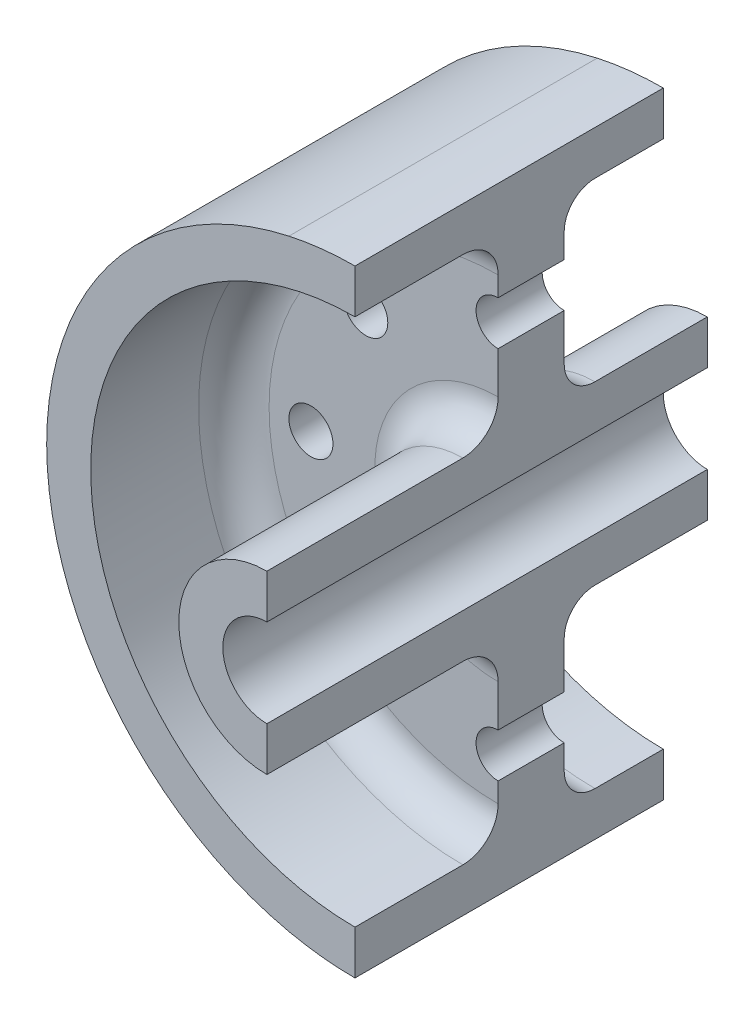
SolidWorks part; units mm, degrees
ref_plane "Front Plane" through (0, 0, 0) normal (0, 0, 1) x (1, 0, 0)
ref_plane "Top Plane" through (0, 0, 0) normal (0, 1, 0) x (1, 0, 0)
ref_plane "Right Plane" through (0, 0, 0) normal (1, 0, 0) x (0, 0, -1)
sketch "Sketch1" plane through (0, 0, 0) normal (1, 0, 0) x (0, 0, -1)
  line L0 (0, 0) -> (254, 0) construction
  line L1 (0, 25.4) -> (254, 25.4)
  line L2 (254, 25.4) -> (254, 50.8)
  line L3 (254, 50.8) -> (171.45, 50.8)
  line L4 (0, 50.8) -> (0, 25.4)
  line L5 (133.35, 50.8) -> (133.35, 152.4)
  line L6 (133.35, 152.4) -> (50.8, 152.4)
  line L7 (50.8, 152.4) -> (50.8, 177.8)
  line L8 (50.8, 177.8) -> (228.6, 177.8)
  line L9 (228.6, 177.8) -> (228.6, 152.4)
  line L10 (228.6, 152.4) -> (171.45, 152.4)
  line L11 (171.45, 152.4) -> (171.45, 50.8)
  line L12 (133.35, 50.8) -> (0, 50.8)
  dimension "D1" = 254
  dimension "D2" = 25.4
  dimension "D3" = 50.8
  dimension "D4" = 152.4
  dimension "D5" = 177.8
  dimension "D6" = 50.8
  dimension "D7" = 133.35
  dimension "D8" = 171.45
  dimension "D9" = 228.6
revolve "Revolve1" add sketch "Sketch1" angle 360 about L0
sketch "Sketch2" plane through (0, 0, 0) normal (0, 0, 1) x (1, 0, 0)
  circle A0 centre (0, 107.95) radius 12.7
  dimension "D1" = 25.4
  dimension "D2" = 107.95
extrude "Extrude1" cut sketch "Sketch2" against normal through all
pattern_circular "CirPattern1" count 8 over 360 about axis through (0, 0, 0) along (0, 0, 1) of "Extrude1"
fillet "Fillet1" radius 20.32 1 edges at (152.4, 0, -133.35)
fillet "Fillet4" radius 20.32 1 edges at (50.8, 0, -133.35)
fillet "Fillet2" radius 17.78 1 edges at (152.4, 0, -171.45)
fillet "Fillet3" radius 17.78 1 edges at (50.8, 0, -171.45)
sketch "Sketch7" plane through (0, 0, 0) normal (0, 1, 0) x (1, 0, 0)
  line L0 (-38.1, 268.1025) -> (-38.1, -3.5575)
  point P2 (0, 0)
  dimension "D1" = 38.1
sketch "Sketch8" plane through (0, 0, 0) normal (0, 1, 0) x (1, 0, 0)
  line L0 (38.1, 261.0725) -> (38.1, 0)
  dimension "D1" = 38.1
sketch "Sketch6" plane through (0, 0, 0) normal (0, 0, 1) x (1, 0, 0)
  line L1 (0, -194.9391) -> (184.9007, -194.9391)
  line L2 (0, -194.9391) -> (0, 190.4057)
  line L3 (0, 190.4057) -> (184.9007, 190.4057)
  line L4 (184.9007, -194.9391) -> (184.9007, 190.4057)
extrude "Extrude2" cut sketch "Sketch6" against normal through all
